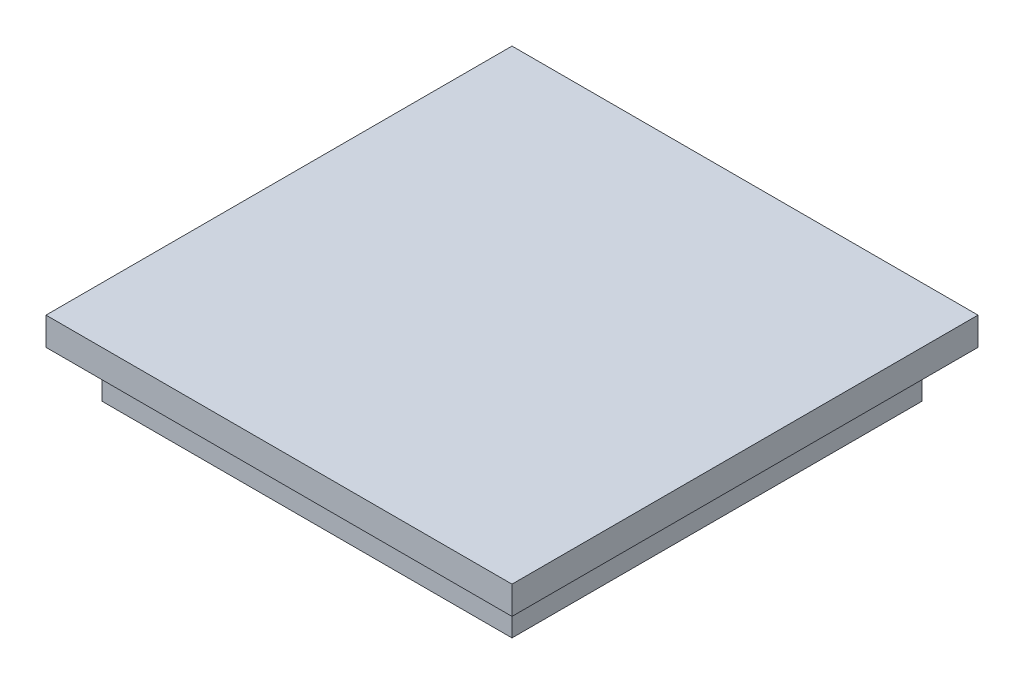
SolidWorks part; units mm, degrees
ref_plane "Plan de face" through (0, 0, 0) normal (0, 0, 1) x (1, 0, 0)
ref_plane "Plan de dessus" through (0, 0, 0) normal (0, 1, 0) x (1, 0, 0)
ref_plane "Plan de droite" through (0, 0, 0) normal (1, 0, 0) x (0, 0, -1)
sketch "Esquisse1" plane through (0, 0, 0) normal (0, 1, 0) x (1, 0, 0)
  line L1 (50, 50) -> (0, 50)
  line L2 (50, 50) -> (50, 0)
  line L3 (50, 0) -> (0, 0)
  line L4 (0, 50) -> (0, 0)
  dimension "D1" = 50
  dimension "D2" = 50
extrude "Extrusion1" add sketch "Esquisse1" along normal blind 3
sketch "Esquisse2" plane through (0, 0, 0) normal (0, -1, 0) x (1, 0, 0)
  line L0 (50, 0) -> (50, -50) construction
  line L1 (3, -3) -> (47, -3)
  line L2 (3, -3) -> (3, -47)
  line L3 (3, -47) -> (47, -47)
  line L4 (47, -3) -> (47, -47)
  line L5 (5, -5) -> (45, -5)
  line L6 (5, -5) -> (5, -45)
  line L7 (5, -45) -> (45, -45)
  line L8 (45, -5) -> (45, -45)
  line L9 (0, -50) -> (0, 0) construction
  line L10 (50, -50) -> (0, -50) construction
  line L11 (0, 0) -> (50, 0) construction
  dimension "D1" = 3
  dimension "D2" = 3
  dimension "D3" = 3
  dimension "D4" = 3
  dimension "D5" = 2
  dimension "D6" = 2
  dimension "D7" = 2
  dimension "D8" = 2
extrude "Extrusion2" add sketch "Esquisse2" along normal blind 5
